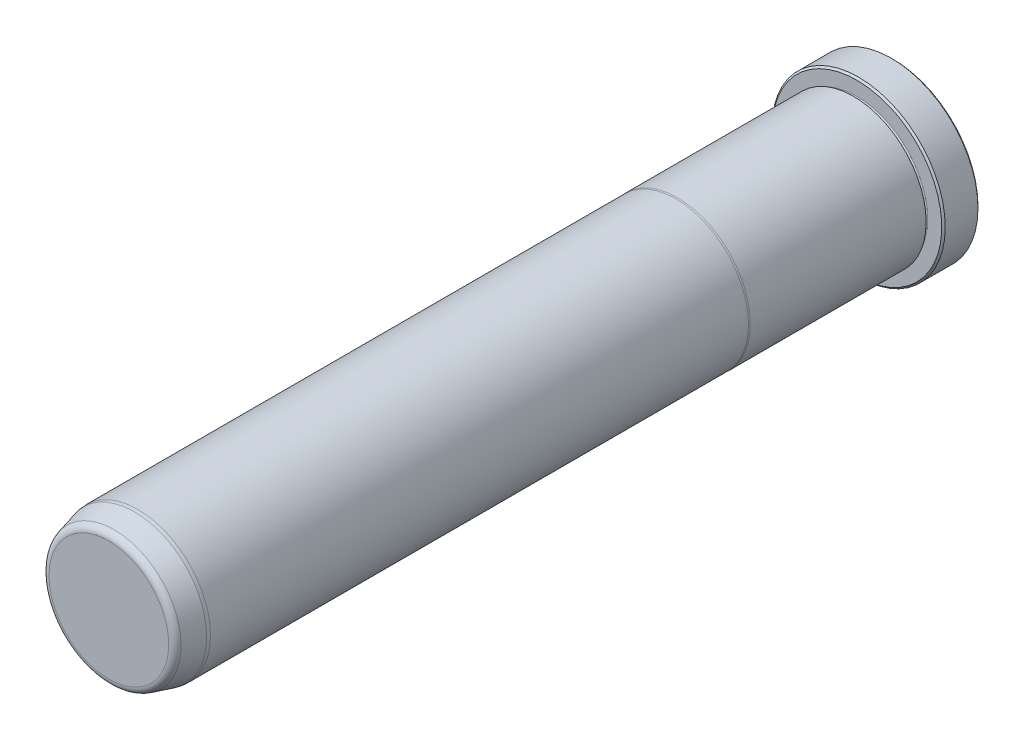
SolidWorks part; units mm, degrees
ref_plane "Front Plane" through (0, 0, 0) normal (0, 0, 1) x (1, 0, 0)
ref_plane "Top Plane" through (0, 0, 0) normal (0, 1, 0) x (1, 0, 0)
ref_plane "Right Plane" through (0, 0, 0) normal (1, 0, 0) x (0, 0, -1)
sketch "Sketch1" plane through (0, 0, 0) normal (1, 0, 0) x (0, 0, -1)
  line L0 (0, 0) -> (0, 18.923)
  line L1 (0, 18.923) -> (-7.9248, 18.923)
  line L2 (-7.9248, 18.923) -> (-7.9248, 15.4813)
  line L3 (-4.7498, 15.1003) -> (-5.5118, 15.1003) construction
  line L4 (-8.6868, 15.4813) -> (-8.6868, 15.8877)
  line L5 (-8.6868, 15.8877) -> (-47.1348, 15.8877)
  line L6 (-47.1348, 15.8877) -> (-47.498, 15.8623)
  line L7 (-47.498, 15.8623) -> (-165.1, 15.8623)
  line L9 (-171.45, 14.2983) -> (-171.45, 0)
  line L10 (-171.45, 0) -> (0, 0)
  line L11 (0, 0) -> (13.6287, 0) construction
  line L12 (-165.1, 15.8623) -> (-165.862, 15.7956)
  line L13 (-165.862, 15.7956) -> (-171.45, 14.2983)
  arc A0 (-8.6868, 15.4813) -> (-7.9248, 15.4813) centre (-8.3058, 15.4813) ccw
  dimension "D14" = 0.762
  dimension "D1" = 7.9248
  dimension "D2" = 0.762
  dimension "D3" = 37.846
  dimension "D4" = 31.7754
  dimension "D5" = 47.498
  dimension "D6" = 171.45
  dimension "D7" = 0.7874
  dimension "D8" = 4
  dimension "D9" = 31.7246
  dimension "D10" = 5
  dimension "D11" = 15
  dimension "D12" = 0.762
  dimension "D13" = 6.35
revolve "Revolve1" add sketch "Sketch1" angle 360 about L11
fillet "Fillet6" radius 1.5875 1 edges at (14.2983, 0, 171.45)
chamfer "Chamfer1" distance 0.381 angle 45 2 edges at (18.923, 0, 0) (18.923, 0, 7.9248)
